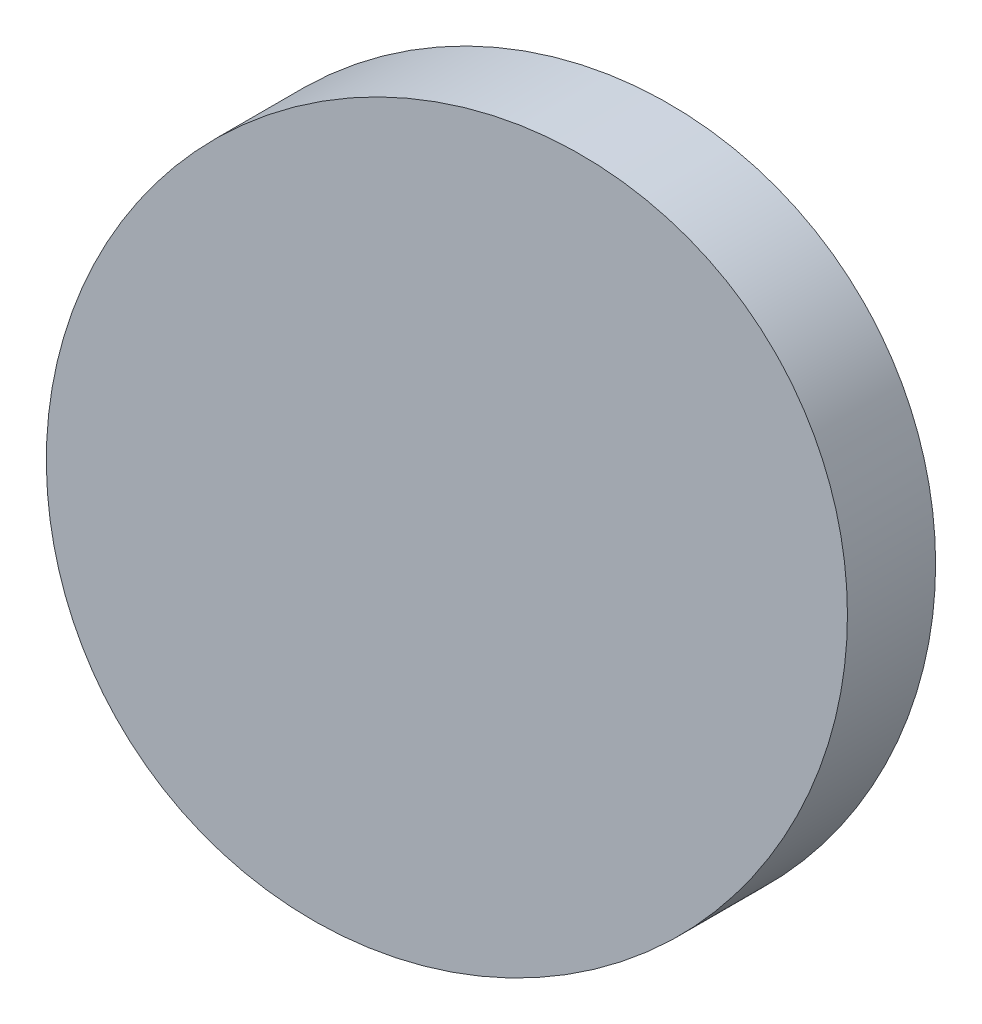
SolidWorks part; units mm, degrees
ref_plane "Ebene vorne" through (0, 0, 0) normal (0, 0, 1) x (1, 0, 0)
ref_plane "Ebene oben" through (0, 0, 0) normal (0, 1, 0) x (1, 0, 0)
ref_plane "Ebene rechts" through (0, 0, 0) normal (1, 0, 0) x (0, 0, -1)
sketch "Sketch1" plane through (0, 0, 0) normal (0, 0, 1) x (1, 0, 0)
  ellipse E0 centre (-12.1749, -6.1403) end of major axis (25.1176, 30.5914) minor radius 36.9766
extrude "Boss-Extrude1" add sketch "Sketch1" along normal blind 10
